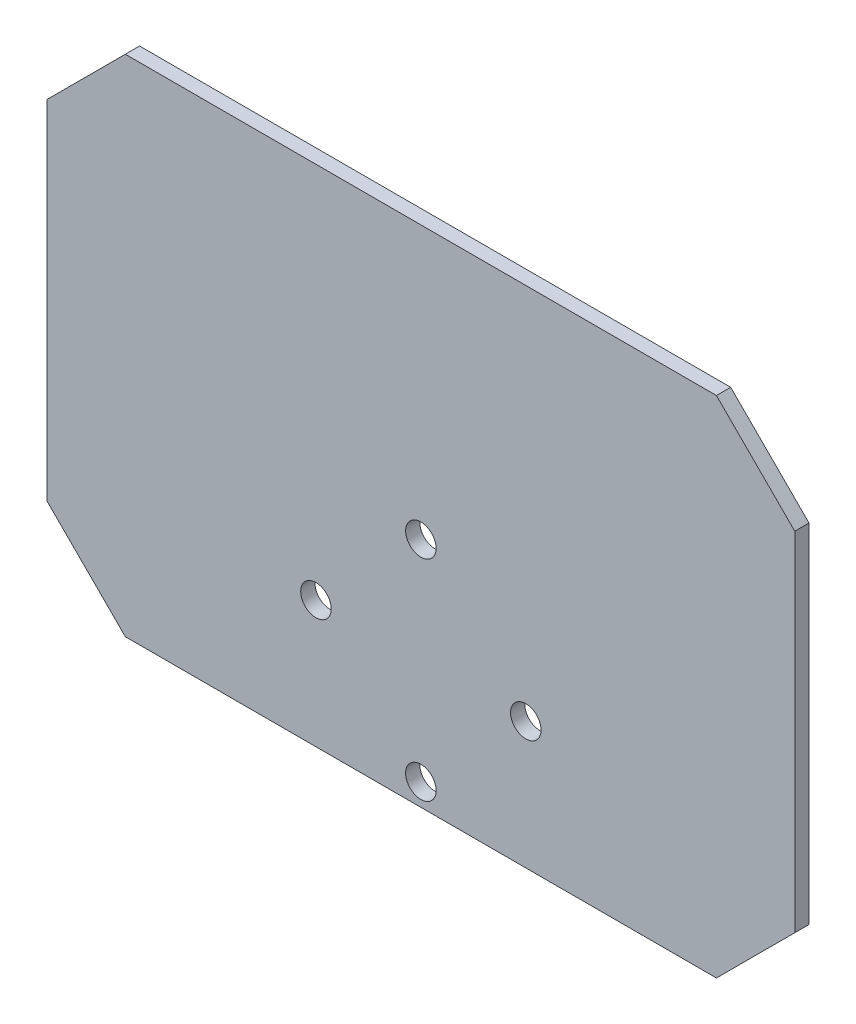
SolidWorks part; units mm, degrees
ref_plane "Front Plane" through (0, 0, 0) normal (0, 0, 1) x (1, 0, 0)
ref_plane "Top Plane" through (0, 0, 0) normal (0, 1, 0) x (1, 0, 0)
ref_plane "Right Plane" through (0, 0, 0) normal (1, 0, 0) x (0, 0, -1)
sketch "Sketch1" plane through (0, 0, 0) normal (0, 0, 1) x (1, 0, 0)
  line L0 (0, 26.9875) -> (0, 0) construction
  line L1 (-40.005, 26.9875) -> (40.005, 26.9875)
  line L2 (-40.005, 26.9875) -> (-40.005, -26.9875)
  line L3 (-40.005, -26.9875) -> (40.005, -26.9875)
  line L4 (40.005, 26.9875) -> (40.005, -26.9875)
  line L5 (0, 0) -> (40.005, 0) construction
  dimension "D1" = 53.975
  dimension "D2" = 80.01
extrude "Boss-Extrude1" add sketch "Sketch1" along normal blind 1.524
chamfer "Chamfer1" distance 8.382 angle 45 4 edges at (-40.005, -26.9875, 0.762) (40.005, -26.9875, 0.762) (40.005, 26.9875, 0.762) (-40.005, 26.9875, 0.762)
hole_wizard "#4 Clearance Hole1" positions "Sketch2" profile "Sketch3" hole size "#4" standard "ANSI Inch"
sketch "Sketch2" plane through (0, 0, 0) normal (0, 0, -1) x (-1, 0, 0)
  line L0 (0, -2.1717) -> (0, -24.6253) construction
  line L2 (-11.2268, -13.3985) -> (11.2268, -13.3985) construction
  line L4 (0, -2.1717) -> (0, 0) construction
  line L6 (0, 2.4765) -> (0, -26.9875) construction
  line L7 (31.623, -26.9875) -> (-31.623, -26.9875) construction
  circle A0 centre (0, -13.3985) radius 11.2268 construction
  circle A1 centre (0, -13.3985) radius 15.875 construction
  point P0 (0, -2.1717)
  point P2 (0, -24.6253)
  point P4 (-11.2268, -13.3985)
  point P6 (11.2268, -13.3985)
  dimension "D1" = 22.4536
  dimension "D2" = 31.75
  dimension "D3" = 29.464
sketch "Sketch3" plane through (0, -2.1717, 0) normal (1, 0, 0) x (0, 1, 0)
  line L0 (0, 0) -> (0, 26.3806)
  line L1 (0, 26.3806) -> (1.6319, 25.4)
  line L2 (1.6319, 25.4) -> (1.6319, 0)
  line L5 (1.6319, 0) -> (0, 0)
  line L10 (0, 26.3806) -> (-1.632, 25.4) construction
  line L11 (0, -6.35) -> (0, 107.95) construction
  dimension "Hole Dia." = 3.2639
  dimension "Hole Depth" = 25.4
  dimension "Drill Angle" = 118
